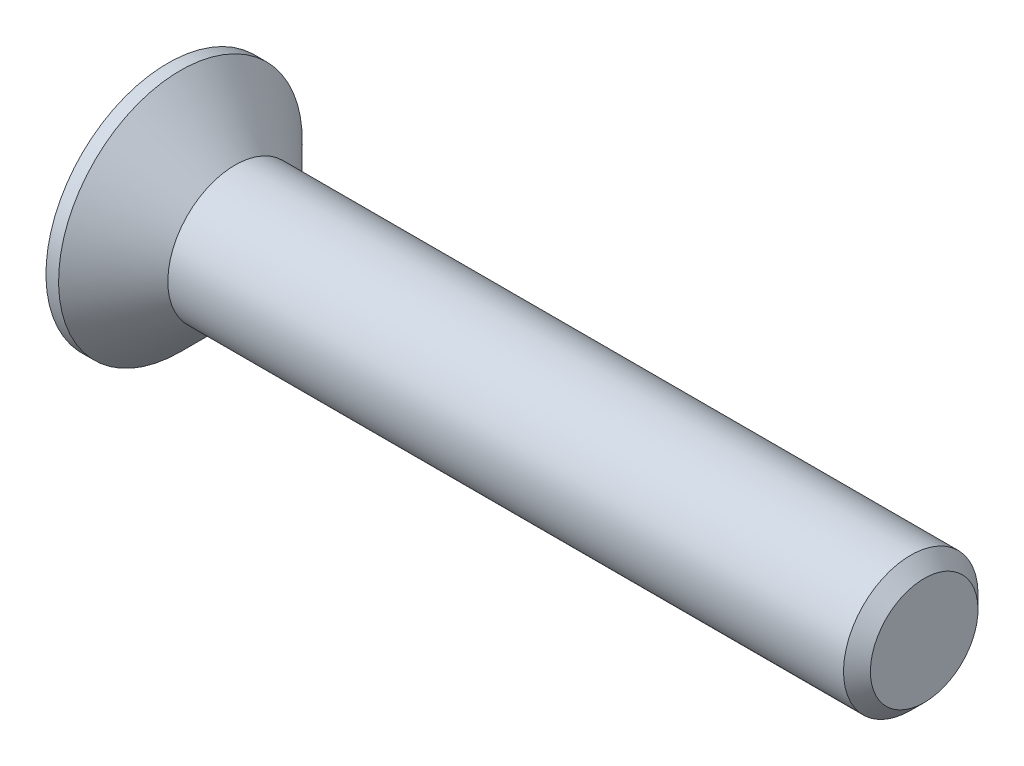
SolidWorks part; units mm, degrees
ref_plane "Front Plane" through (0, 0, 0) normal (0, 0, 1) x (1, 0, 0)
ref_plane "Top Plane" through (0, 0, 0) normal (0, 1, 0) x (1, 0, 0)
ref_plane "Right Plane" through (0, 0, 0) normal (1, 0, 0) x (0, 0, -1)
sketch "Sketch1" plane through (0, 0, 0) normal (0, 0, 1) x (1, 0, 0)
  line L1 (-4, 7.25) -> (-4, 0)
  line L2 (-4, 0) -> (41, 0)
  line L3 (41, 0) -> (41, 4)
  line L4 (41, 4) -> (0, 4)
  line L5 (-4, 7.25) -> (-3.25, 7.25)
  line L6 (-3.25, 7.25) -> (0, 4)
  dimension "D1" = 4
  dimension "D2" = 45
  dimension "D3" = 4
  dimension "D4" = 45
  dimension "D5" = 7.25
revolve "Revolve1" add sketch "Sketch1" angle 360 about L2
chamfer "Chamfer1" distance 0.8 angle 45 1 edges at (41, -4, 0)
sketch "Sketch2" plane through (-4, 0, 0) normal (-1, 0, 0) x (0, 0, 1)
  line L0 (-1.09, 4.35) -> (1.09, 4.35)
  line L1 (1.09, 4.35) -> (1.09, 1.09)
  line L2 (1.09, 1.09) -> (4.35, 1.09)
  line L3 (4.35, 1.09) -> (4.35, -1.09)
  line L4 (4.35, -1.09) -> (1.09, -1.09)
  line L5 (1.09, -1.09) -> (1.09, -4.35)
  line L6 (1.09, -4.35) -> (-1.09, -4.35)
  line L7 (-1.09, -4.35) -> (-1.09, -1.09)
  line L8 (-1.09, -1.09) -> (-4.35, -1.09)
  line L9 (-4.35, -1.09) -> (-4.35, 1.09)
  line L10 (-4.35, 1.09) -> (-1.09, 1.09)
  line L11 (-1.09, 1.09) -> (-1.09, 4.35)
  point P2 (0, 4.35)
  point P14 (0, -4.35)
  point P15 (4.35, 0)
  point P16 (-4.35, 0)
  dimension "D1" = 8.7
  dimension "D2" = 2.18
extrude "Cut-Extrude1" cut sketch "Sketch2" against normal blind 3.45
